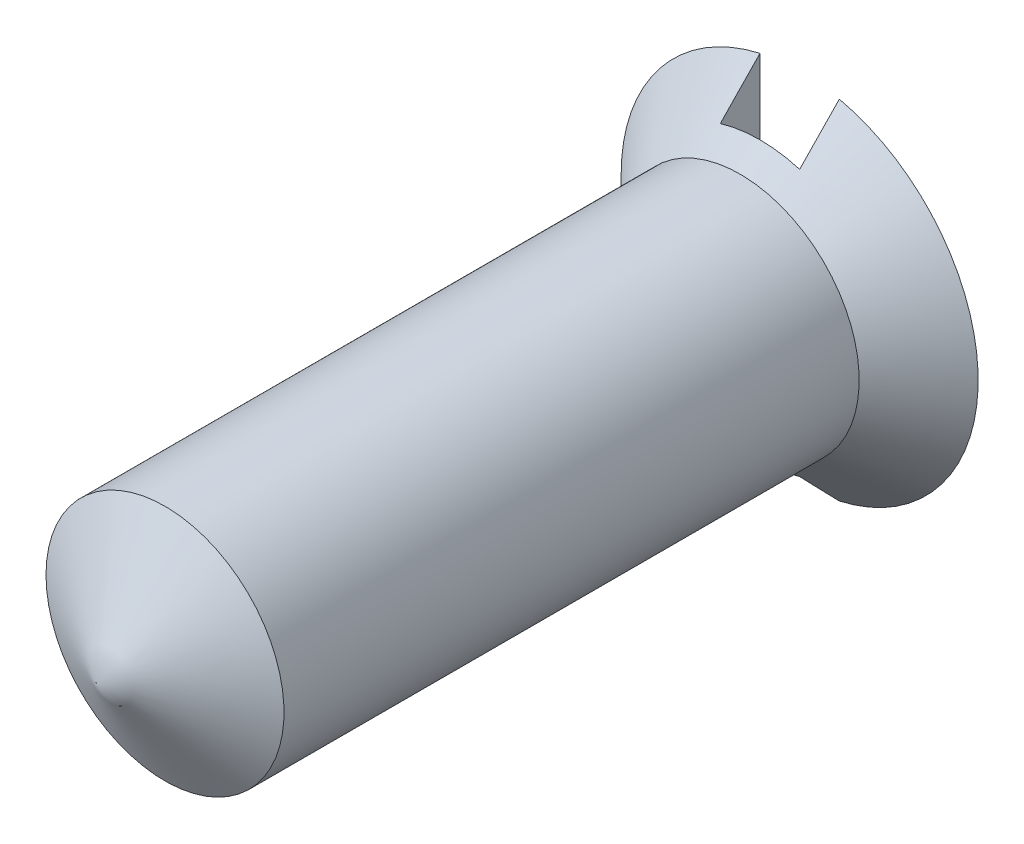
SolidWorks part; units mm, degrees
ref_plane "Front Plane" through (0, 0, 0) normal (0, 0, 1) x (1, 0, 0)
ref_plane "Top Plane" through (0, 0, 0) normal (0, 1, 0) x (1, 0, 0)
ref_plane "Right Plane" through (0, 0, 0) normal (1, 0, 0) x (0, 0, -1)
sketch "Sketch1" plane through (0, 0, 0) normal (0, 1, 0) x (1, 0, 0)
  line L0 (0, 0) -> (0, 17.7321)
  line L1 (0, 17.7321) -> (4.5, 17.7321)
  line L2 (4.5, 17.7321) -> (3, 16.2321)
  line L3 (3, 16.2321) -> (3, 1.7321)
  line L4 (3, 1.7321) -> (0, 0)
  line L5 (0, 0) -> (0, -5.5994) construction
  line L6 (13.1251, 17.7321) -> (4.5, 17.7321) construction
  line L7 (4.5, 17.7321) -> (10.0125, 23.2446) construction
  line L8 (-4.5, 17.7321) -> (-3, 16.2321) construction
  dimension "D1" = 9
  dimension "D2" = 6
  dimension "D3" = 120
  dimension "D4" = 16
  dimension "D5" = 90
revolve "Revolve1" add sketch "Sketch1" angle 360 about L5
sketch "Sketch2" plane through (0, 0, -17.7321) normal (0, 0, -1) x (-1, 0, 0)
  line L1 (-1, -5.2264) -> (1, -5.2264)
  line L2 (-1, -5.2264) -> (-1, 5.2264)
  line L3 (-1, 5.2264) -> (1, 5.2264)
  line L4 (1, -5.2264) -> (1, 5.2264)
  line L5 (-1, -5.2264) -> (1, 5.2264) construction
  line L6 (-1, 5.2264) -> (1, -5.2264) construction
  point P0 (0, 0)
  dimension "D1" = 2
extrude "Cut-Extrude1" cut sketch "Sketch2" against normal blind 1
